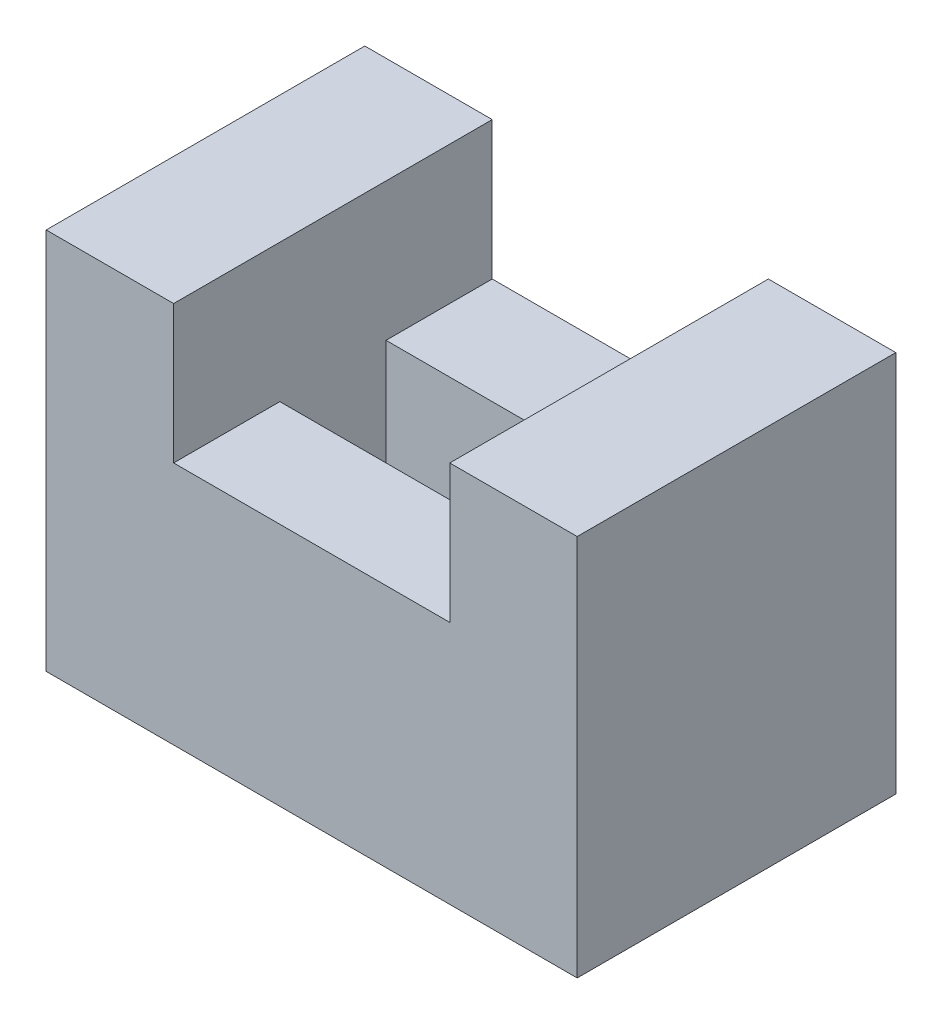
SolidWorks part; units mm, degrees
ref_plane "前视基准面" through (0, 0, 0) normal (0, 0, 1) x (1, 0, 0)
ref_plane "上视基准面" through (0, 0, 0) normal (0, 1, 0) x (1, 0, 0)
ref_plane "右视基准面" through (0, 0, 0) normal (1, 0, 0) x (0, 0, -1)
sketch "草图1" plane through (0, 0, 0) normal (0, 0, 1) x (1, 0, 0)
  line L0 (-50, -37.8779) -> (50, -37.8779)
  line L1 (50, -37.8779) -> (50, 34.1221)
  line L2 (50, 34.1221) -> (26, 34.1221)
  line L3 (26, 34.1221) -> (26, 8.1221)
  line L4 (26, 8.1221) -> (-26, 8.1221)
  line L5 (-26, 8.1221) -> (-26, 34.1221)
  line L6 (-26, 34.1221) -> (-50, 34.1221)
  line L7 (-50, 34.1221) -> (-50, -37.8779)
  line L8 (0, 0) -> (0, 66.2371) construction
  line L9 (0, 66.2371) -> (0, 0) construction
  line L10 (0, 0) -> (93.5348, 0) construction
extrude "拉伸1" add sketch "草图1" against normal blind 60
sketch "草图2" plane through (0, 8.1221, 0) normal (0, 1, 0) x (1, 0, 0)
  line L0 (0, 0) -> (0, 60) construction
  line L1 (-26, 40) -> (26, 40)
  line L2 (-26, 40) -> (-26, 20)
  line L3 (-26, 20) -> (26, 20)
  line L4 (26, 40) -> (26, 20)
  line L6 (26, 60) -> (-26, 60) construction
  line L7 (0, 60) -> (0, 30) construction
  line L8 (0, 30) -> (36.2388, 30) construction
  line L9 (26, 60) -> (26, 0) construction
extrude "切除-拉伸1" cut sketch "草图2" against normal through all
